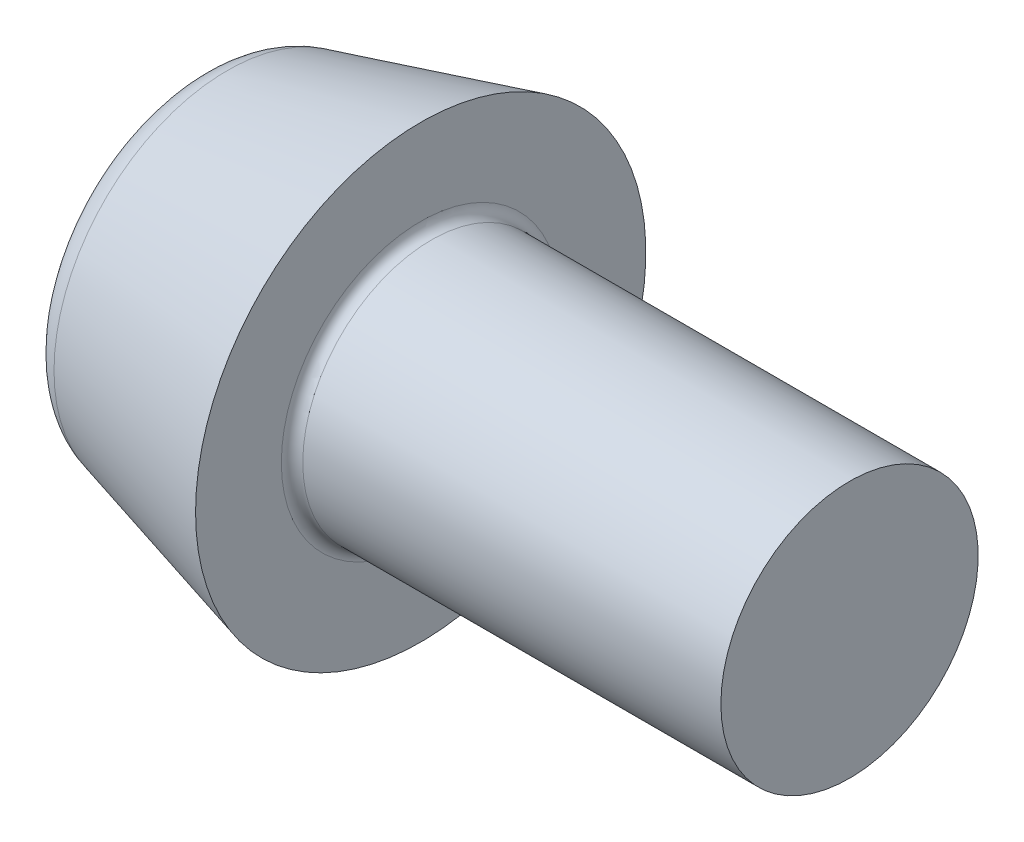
SolidWorks part; units mm, degrees
ref_plane "Front" through (0, 0, 0) normal (0, 0, 1) x (1, 0, 0)
ref_plane "Top" through (0, 0, 0) normal (0, 1, 0) x (1, 0, 0)
ref_plane "Right" through (0, 0, 0) normal (1, 0, 0) x (0, 0, -1)
other "Configuration Table"
sketch "Sketch1" plane through (0, 0, 0) normal (0, 0, 1) x (1, 0, 0)
  line L0 (0, 0) -> (30.5, 0)
  line L1 (30.5, 0) -> (30.5, 6)
  line L2 (30.5, 6) -> (10.5, 6)
  line L3 (10.5, 6) -> (10.5, 10.5)
  line L4 (10.5, 10.5) -> (0, 7.6865)
  line L5 (0, 7.6865) -> (0, 0)
  line L6 (-26.4886, 0) -> (67.8543, 0) construction
  line L7 (-6.0327, 10.5) -> (19.105, 10.5) construction
  dimension "D1" = 15
  dimension "L" = 20
  dimension "d" = 12
  dimension "K" = 10.5
  dimension "dk" = 21
revolve "Base-Revolve" add sketch "Sketch1" angle 360 about L6
fillet "Fillet1" radius 0.5 1 edges at (10.5, 0, 6)
fillet "Fillet2" radius 2 1 edges at (0, 0, 7.6865)
